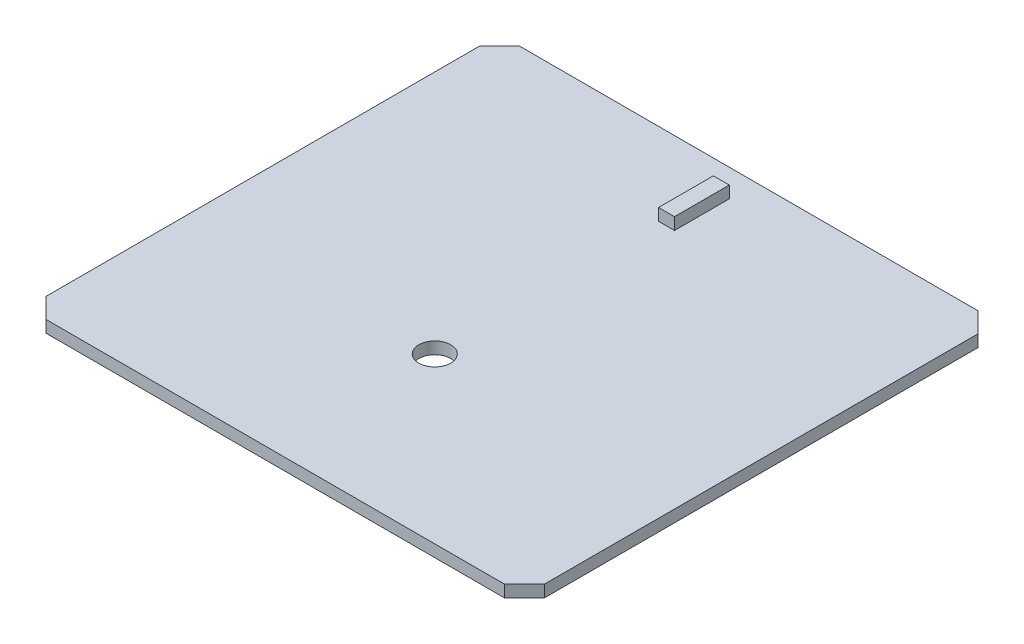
SolidWorks part; units mm, degrees
ref_plane "Спереди" through (0, 0, 0) normal (0, 0, 1) x (1, 0, 0)
ref_plane "Сверху" through (0, 0, 0) normal (0, 1, 0) x (1, 0, 0)
ref_plane "Справа" through (0, 0, 0) normal (1, 0, 0) x (0, 0, -1)
sketch "Эскиз1" plane through (0, 0, 0) normal (0, 1, 0) x (1, 0, 0)
  line L0 (-23, 23.75) -> (-25, 21.75)
  line L1 (23, -23.75) -> (-23, -23.75)
  line L2 (25, -21.75) -> (25, 21.75)
  line L3 (23, 23.75) -> (-23, 23.75)
  line L4 (-25, -21.75) -> (-25, 21.75)
  line L5 (25, -23.75) -> (-25, 23.75) construction
  line L6 (25, 23.75) -> (-25, -23.75) construction
  line L7 (25, 21.75) -> (23, 23.75)
  line L8 (25, -21.75) -> (23, -23.75)
  line L9 (-23, -23.75) -> (-25, -21.75)
  circle A0 centre (-0.5, -7.25) radius 1.6
  point P0 (0, 0)
  dimension "D5" = 3.2
  dimension "D1" = 47.5
  dimension "D2" = 50
  dimension "D3" = 24.5
  dimension "D4" = 31
extrude "Бобышка-Вытянуть1" add sketch "Эскиз1" along normal blind 1.2
ref_plane "Плоскость1" through (0, 1.2, 0) normal (0, 1, 0) x (1, 0, 0)
sketch "Эскиз2" plane through (0, 1.2, 0) normal (0, 1, 0) x (1, 0, 0)
  line L0 (23, 23.75) -> (-23, 23.75) construction
  line L1 (-0.8, 15.5) -> (0.8, 15.5)
  line L2 (-0.8, 15.5) -> (-0.8, 21)
  line L3 (-0.8, 21) -> (0.8, 21)
  line L4 (0.8, 15.5) -> (0.8, 21)
  line L5 (-0.8, 15.5) -> (0.8, 21) construction
  line L6 (-0.8, 21) -> (0.8, 15.5) construction
  line L7 (-25, 21.75) -> (-25, -21.75) construction
  point P0 (0, 18.25)
  dimension "D1" = 5.5
  dimension "D2" = 1.6
  dimension "D3" = 5.5
  dimension "D4" = 25
extrude "Бобышка-Вытянуть2" add sketch "Эскиз2" along normal blind 1.2
ref_plane "Плоскость2" through (0, 0, 0) normal (0, -1, 0) x (-1, 0, 0)
sketch "Эскиз3" plane through (0, 0, 0) normal (0, -1, 0) x (-1, 0, 0)
  line L0 (-23, 23.75) -> (23, 23.75) construction
  line L1 (8.5, -13.5) -> (15.5, -13.5)
  line L2 (8.5, -13.5) -> (8.5, -9)
  line L3 (8.5, -9) -> (15.5, -9)
  line L4 (15.5, -13.5) -> (15.5, -9)
  line L5 (8.5, -13.5) -> (15.5, -9) construction
  line L6 (8.5, -9) -> (15.5, -13.5) construction
  line L7 (25, 21.75) -> (25, -21.75) construction
  point P0 (12, -11.25)
  dimension "D1" = 7
  dimension "D2" = 4.5
  dimension "D3" = 35
  dimension "D4" = 13
extrude "Бобышка-Вытянуть3" add sketch "Эскиз3" along normal blind 3
